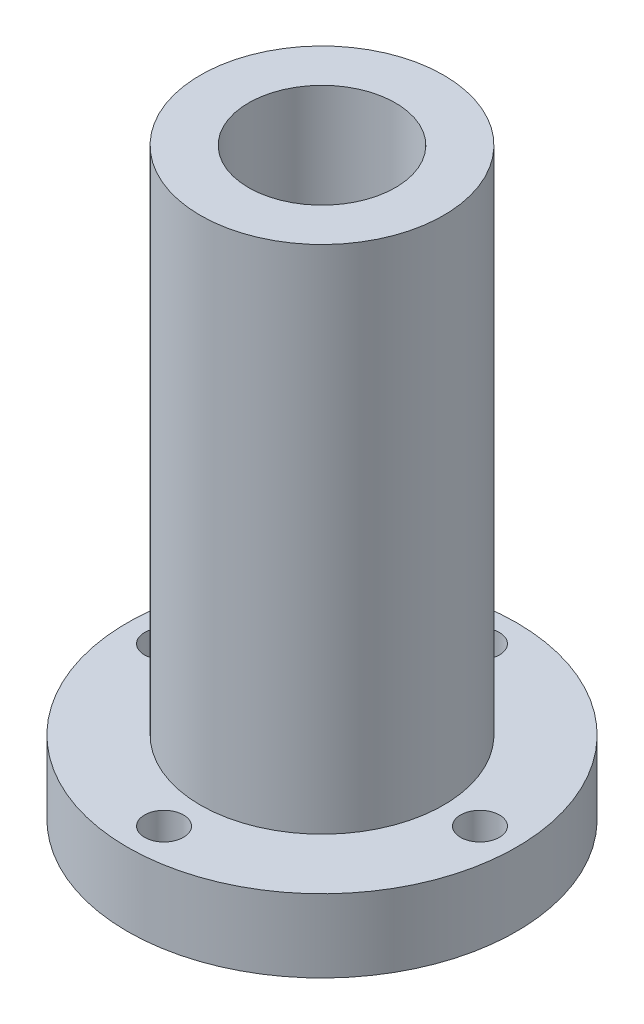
SolidWorks part; units mm, degrees
ref_plane "Front Plane" through (0, 0, 0) normal (0, 0, 1) x (1, 0, 0)
ref_plane "Top Plane" through (0, 0, 0) normal (0, 1, 0) x (1, 0, 0)
ref_plane "Right Plane" through (0, 0, 0) normal (1, 0, 0) x (0, 0, -1)
sketch "Sketch1" plane through (0, 0, 0) normal (0, 1, 0) x (1, 0, 0)
  circle A0 centre (0, 0) radius 25.4
  dimension "D1" = 50.8
extrude "Extrude1" add sketch "Sketch1" against normal blind 76.2
sketch "Sketch2" plane through (0, 0, 0) normal (0, 1, 0) x (-1, 0, 0)
  circle A0 centre (0, 0) radius 9.5885
  dimension "D1" = 19.177
extrude "Cut-Extrude1" cut sketch "Sketch2" against normal through all
sketch "Sketch3" plane through (0, 0, 0) normal (0, 1, 0) x (-1, 0, 0)
  circle A0 centre (0, 0) radius 15.875
  dimension "D1" = 31.75
extrude "Cut-Extrude2" cut sketch "Sketch3" against normal blind 66.675 flip side to cut
sketch "Sketch4" plane through (0, -66.675, 0) normal (0, 1, 0) x (-1, 0, 0)
  circle A0 centre (0, -20.6248) radius 2.54
  circle A1 centre (0, 20.6248) radius 2.54
  circle A2 centre (-20.6248, 0) radius 2.54
  circle A3 centre (20.6248, 0) radius 2.54
  circle A4 centre (0, 0) radius 25.4 construction
  dimension "D1" = 20.6248
  dimension "D2" = 5.08
  dimension "D3" = 5.08
  dimension "D4" = 5.08
  dimension "D5" = 5.08
  dimension "D6" = 20.6248
  dimension "D7" = 20.6248
  dimension "D8" = 20.6248
extrude "Cut-Extrude3" cut sketch "Sketch4" against normal through all
